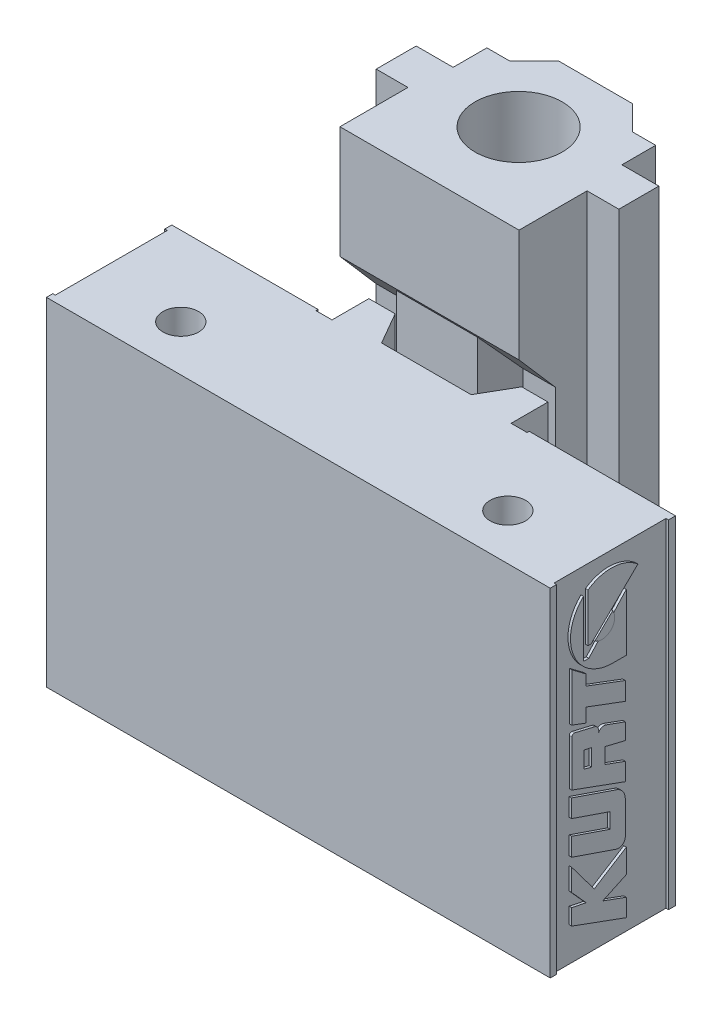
SolidWorks part; units mm, degrees
ref_plane "Front" through (0, 0, 0) normal (0, 0, 1) x (1, 0, 0)
ref_plane "Top" through (0, 0, 0) normal (0, 1, 0) x (1, 0, 0)
ref_plane "Right" through (0, 0, 0) normal (1, 0, 0) x (0, 0, -1)
imported_body "Imported1"
imported_body "Imported2"
other "Move Face1" parameters "D1"=2
